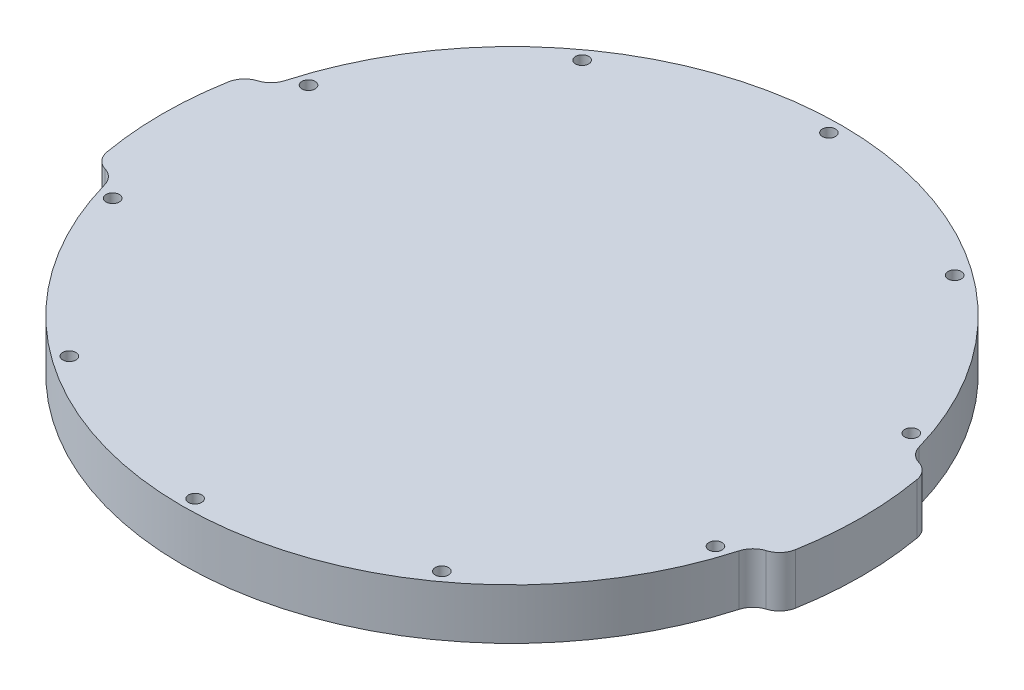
SolidWorks part; units mm, degrees
ref_plane "Front Plane" through (0, 0, 0) normal (0, 0, 1) x (1, 0, 0)
ref_plane "Top Plane" through (0, 0, 0) normal (0, 1, 0) x (1, 0, 0)
ref_plane "Right Plane" through (0, 0, 0) normal (1, 0, 0) x (0, 0, -1)
sketch "Sketch1" plane through (0, 0, 0) normal (0, 1, 0) x (1, 0, 0)
  line L0 (0, 0) -> (-86.2199, 15.2029) construction
  line L1 (0, 0) -> (-139.7786, 0) construction
  line L2 (0, 0) -> (-86.2199, -15.2029) construction
  line L3 (0, 0) -> (86.2199, 15.2029) construction
  line L4 (0, 0) -> (86.2199, -15.2029) construction
  circle A0 centre (0, 0) radius 79.35 construction
  circle A1 centre (0, 79.35) radius 1.65
  circle A2 centre (46.6408, 64.1955) radius 1.65
  circle A3 centre (75.4663, 24.5205) radius 1.65
  circle A4 centre (75.4663, -24.5205) radius 1.65
  circle A5 centre (46.6408, -64.1955) radius 1.65
  circle A6 centre (0, -79.35) radius 1.65
  circle A7 centre (-46.6408, -64.1955) radius 1.65
  circle A8 centre (-75.4663, -24.5205) radius 1.65
  circle A9 centre (-75.4663, 24.5205) radius 1.65
  circle A10 centre (-46.6408, 64.1955) radius 1.65
  circle A13 centre (0, 0) radius 82.55 construction
  circle A14 centre (0, 0) radius 87.55 construction
  arc A15 (-86.2199, -15.2029) -> (-86.2199, 15.2029) centre (0, 0) cw
  arc A16 (86.2199, -15.2029) -> (86.2199, 15.2029) centre (0, 0) ccw
  arc A17 (-86.2199, -15.2029) -> (-80.2789, -19.2301) centre (-81.2959, -14.3347) ccw
  arc A18 (-86.2199, 15.2029) -> (-80.2789, 19.2301) centre (-81.2959, 14.3347) cw
  arc A19 (86.2199, -15.2029) -> (80.2789, -19.2301) centre (81.2959, -14.3347) cw
  arc A20 (86.2199, 15.2029) -> (80.2789, 19.2301) centre (81.2959, 14.3347) ccw
  arc A21 (-80.2789, 19.2301) -> (80.2789, 19.2301) centre (0, 0) cw
  arc A22 (80.2789, -19.2301) -> (-80.2789, -19.2301) centre (0, 0) cw
  point P28 (0, 0)
  point P30 (0, 0)
  dimension "D1" = 3.3
  dimension "D2" = 158.7
  dimension "D4" = 165.1
  dimension "D5" = 5
  dimension "D6" = 10
extrude "Boss-Extrude1" add sketch "Sketch1" along normal blind 12.7
fillet "Fillet1" radius 5 4 edges at (80.2789, 6.35, 19.2301) (80.2789, 6.35, -19.2301) (-80.2789, 6.35, -19.2301) (-80.2789, 6.35, 19.2301)
